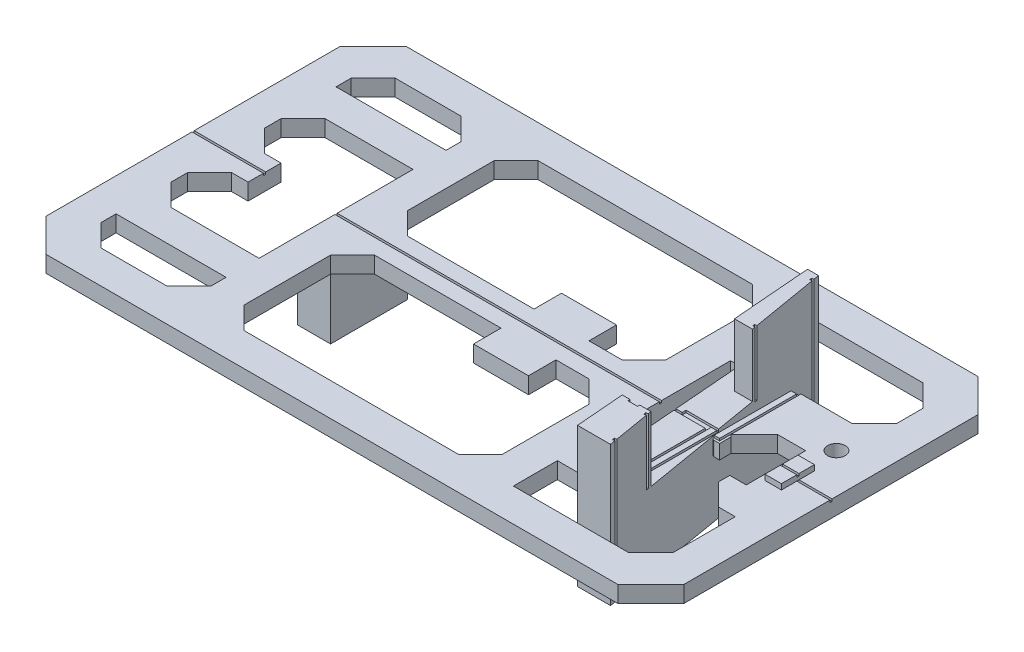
SolidWorks part; units mm, degrees
ref_plane "Front Plane" through (0, 0, 0) normal (0, 0, 1) x (1, 0, 0)
ref_plane "Top Plane" through (0, 0, 0) normal (0, 1, 0) x (1, 0, 0)
ref_plane "Right Plane" through (0, 0, 0) normal (1, 0, 0) x (0, 0, -1)
sketch "Sketch1" plane through (0, 0, 0) normal (0, 1, 0) x (1, 0, 0)
  line L0 (58, 0) -> (21.5339, 0) construction
  line L1 (57, -32.75) -> (-47, -32.75)
  line L2 (-53, -26.75) -> (-53, 26.75)
  line L3 (57, 32.75) -> (-47, 32.75)
  line L4 (-53, 26.75) -> (-47, 32.75)
  line L5 (-47, -32.75) -> (-53, -26.75)
  line L6 (63, -26.75) -> (57, -32.75)
  line L7 (63, 26.75) -> (57, 32.75)
  line L8 (43.65, -0.9) -> (43.65, 1.2)
  line L9 (57, 17.9) -> (53, 13.9)
  line L10 (-40, -3) -> (-40, 3)
  line L11 (26, -7) -> (26, -22.75)
  line L12 (53, -26.75) -> (57, -22.75)
  line L13 (32, -18.75) -> (32, -26.75)
  line L14 (-27, 14) -> (-27, -14)
  line L15 (32, 5) -> (32, -28.4056) construction
  line L16 (57, 17.9) -> (57, 22.75)
  line L17 (53, 26.75) -> (57, 22.75)
  line L18 (36.3225, 18.75) -> (36, 22.75)
  line L19 (39.6688, -22.75) -> (39.3462, -18.75)
  line L20 (42.25, -0.5) -> (42.25, 9.5)
  line L21 (-27, 22.75) -> (-27, 7) construction
  line L22 (-31, 26.75) -> (-43, 26.75)
  line L23 (-21, 22.75) -> (-21, 7)
  line L24 (26, 22.75) -> (26, 7)
  line L25 (63, -26.75) -> (63, 26.75)
  line L26 (26, 7) -> (22, 3)
  line L27 (53, 13.9) -> (42.25, 13.9)
  line L28 (22, 26.75) -> (26, 22.75)
  line L29 (26, 5) -> (26, -28.4056) construction
  line L30 (22, -3) -> (26, -7)
  line L31 (26, -22.75) -> (22, -26.75)
  line L32 (32, -18.75) -> (39.3462, -18.75)
  line L33 (32, -26.75) -> (53, -26.75)
  line L34 (16, 8) -> (6, 8)
  line L35 (45.6685, -22.75) -> (39.6688, -22.75)
  line L36 (57, -11.4) -> (57, -22.75)
  line L37 (-21, -7) -> (-21, -22.75)
  line L38 (45.6685, -22.75) -> (38, 22.75)
  line L39 (41.85, 9.9) -> (41.85, 13.5)
  line L40 (50, -5.4) -> (53, -5.4)
  line L41 (22, 26.75) -> (-17, 26.75)
  line L42 (47.85, 5.4) -> (43.65, 1.2)
  line L43 (16, -8) -> (6, -8)
  line L44 (-47, 20) -> (-47, 22.75)
  line L45 (43.65, -0.9) -> (42.65, -0.9)
  line L46 (16, 8) -> (16, 3)
  line L47 (53, 5.4) -> (53, -5.4)
  line L48 (32, 18.75) -> (32, 26.75)
  line L49 (54, -11.4) -> (57, -11.4)
  line L50 (32, 26.75) -> (53, 26.75)
  line L51 (43.65, -0.5) -> (43.65, 9.5) construction
  line L52 (38, 22.75) -> (36, 22.75)
  line L53 (32, 18.75) -> (36.3225, 18.75)
  line L54 (47.85, -11.4) -> (53, -11.4) construction
  line L55 (41.85, -0.5) -> (41.85, 13.5) construction
  line L56 (6, 8) -> (6, 3)
  line L57 (-27, 14) -> (-43, 14)
  line L58 (32, -12.75) -> (35.6569, -12.75)
  line L59 (22, 3) -> (16, 3)
  line L60 (58, 8) -> (21.5339, 8) construction
  line L61 (32, 12.75) -> (33.6008, 12.75)
  line L62 (42.25, -0.5) -> (42.25, 13.5) construction
  line L63 (6, 22.75) -> (6, 7) construction
  line L64 (32, 12.75) -> (32, -12.75)
  line L65 (32, 12.75) -> (36.3225, 12.75) construction
  line L66 (32, -12.75) -> (39.3462, -12.75) construction
  line L67 (22, -3) -> (16, -3)
  line L68 (58, -8) -> (21.5339, -8) construction
  line L69 (33.6008, 12.75) -> (35.6569, -12.75)
  line L70 (16, 22.75) -> (16, 7) construction
  line L71 (6, -3) -> (6, -8)
  line L72 (16, -3) -> (16, -8)
  line L73 (6, 3) -> (-17, 3)
  line L74 (6, -3) -> (-17, -3)
  line L75 (22, -26.75) -> (-17, -26.75)
  line L76 (-27, -14) -> (-43, -14)
  line L77 (50, -7.4) -> (54, -11.4)
  line L78 (50, -5.4) -> (50, -7.4)
  line L79 (-40, -26.75) -> (-40, 26.75) construction
  line L80 (-27, 20) -> (-47, 20)
  line L81 (-27, 22.75) -> (-27, 20)
  line L82 (-27, -20) -> (-27, -22.75)
  line L83 (-31, -26.75) -> (-43, -26.75)
  line L84 (-27, 20) -> (-40, 20) construction
  line L85 (-47, -26.75) -> (-47, 26.75) construction
  line L86 (-17, 26.75) -> (-21, 22.75)
  line L87 (-27, 22.75) -> (-27, 7) construction
  line L88 (-21, -22.75) -> (-17, -26.75)
  line L89 (-17, -3) -> (-21, -7)
  line L90 (-17, 3) -> (-21, 7)
  line L91 (57, 26.75) -> (-47, 26.75) construction
  line L92 (-27, -7) -> (-27, -22.75) construction
  line L93 (57, -26.75) -> (-47, -26.75) construction
  line L94 (-47, -20) -> (-47, -22.75)
  line L95 (-27, -20) -> (-47, -20)
  line L96 (-27, -20) -> (-40, -20) construction
  line L97 (-43, -26.75) -> (-47, -22.75)
  line L98 (-47, 22.75) -> (-43, 26.75)
  line L99 (-43, 14) -> (-47, 10)
  line L100 (-43, -3) -> (-40, -3)
  line L101 (-43, 3) -> (-40, 3)
  line L102 (-47, 10) -> (-47, 7)
  line L103 (-47, -10) -> (-47, -7)
  line L104 (-47, 7) -> (-43, 3)
  line L105 (-47, -7) -> (-43, -3)
  line L106 (-27, 14) -> (-40, 14) construction
  line L107 (-27, -14) -> (-40, -14) construction
  line L108 (-43, -14) -> (-47, -10)
  line L109 (-31, 26.75) -> (-27, 22.75)
  line L110 (-27, -22.75) -> (-31, -26.75)
  line L111 (47.85, 5.4) -> (53, 5.4)
  line L112 (50, 5.4) -> (50, -5.4) construction
  line L113 (47.85, -5.4) -> (53, -5.4) construction
  circle A0 centre (55.7955, 8.2073) radius 1.6
  arc A3 (42.65, -0.9) -> (42.25, -0.5) centre (42.65, -0.5) cw
  arc A8 (41.85, 9.9) -> (42.25, 9.5) centre (42.25, 9.9) ccw
  arc A9 (42.25, 13.9) -> (41.85, 13.5) centre (42.25, 13.5) ccw
  point P2 (-53, 32.75)
  point P3 (-53, -32.75)
  point P5 (57, 26.75)
  point P15 (57, 13.9)
  point P28 (63, -32.75)
  point P29 (57, -26.75)
  point P31 (63, 32.75)
  point P51 (-21, -3)
  point P55 (26, -26.75)
  point P83 (26, 26.75)
  point P95 (26, -3)
  point P98 (26, 3)
  point P116 (-27, 26.75)
  point P117 (-27, -26.75)
  point P132 (47.85, 1.2)
  point P137 (50, -11.4)
  point P143 (-47, 14)
  point P144 (-47, -3)
  point P147 (-47, 3)
  point P148 (-47, -14)
  dimension "D20" = 10
  dimension "D3" = 6
  dimension "D12" = 0.4
  dimension "D19" = 0.4
  dimension "D26" = 6
  dimension "D15" = 8
  dimension "D5" = 6
  dimension "D10" = 6
  dimension "D11" = 8
  dimension "D17" = 10
  dimension "D21" = 6
  dimension "D22" = 6
  dimension "D24" = 6
  dimension "D25" = 6
  dimension "D27" = 3
  dimension "D7" = 1.4
  dimension "D8" = 13
  dimension "D29" = 0.4
  dimension "D9" = 6
extrude "Boss-Extrude1" add sketch "Sketch1" along normal blind 3
sketch "Sketch2" plane through (0, 3, 0) normal (0, 1, 0) x (1, 0, 0)
  line L0 (43.65, 0.1843) -> (63, 0.2055)
  line L1 (40.75, 0.5) -> (40.75, -13.5)
  line L2 (48.25, -13.9) -> (48.25, -0.2)
  line L3 (-53, -0.2) -> (40.35, -0.2)
  line L4 (-53, 0.2) -> (35.75, 0.2)
  line L6 (35.75, 0.9) -> (35.75, 0.2)
  line L7 (41.75, -13.5) -> (41.75, 0.5)
  line L10 (48.25, -0.2) -> (63, -0.2)
  line L13 (35.75, 0.5) -> (35.75, -13.5) construction
  line L14 (42.25, 13.5) -> (43.25, 13.5)
  line L15 (43.25, 13.5) -> (43.25, -0.5)
  line L16 (43.25, -0.5) -> (42.25, -0.5)
  line L17 (41.75, 0.5) -> (40.75, 0.5)
  line L18 (41.75, -13.5) -> (40.75, -13.5)
  line L20 (40.35, -13.9) -> (48.25, -13.9)
  line L22 (41.8, 0.9) -> (35.75, 0.9)
  line L24 (-58, 0.2) -> (40.35, 0.2) construction
  line L25 (40.35, -13.9) -> (40.35, -0.2)
  line L27 (63, -0.2) -> (63, 0.2055)
  line L28 (41.8, 0.9) -> (41.8, 13.9)
  line L30 (-53, 0.2) -> (-53, -0.2)
  line L31 (43.65, 13.9) -> (41.8, 13.9)
  line L32 (-53, 26.75) -> (-53, -26.75) construction
  line L33 (43.65, 0.1843) -> (43.65, 13.9)
  line L34 (-58, -0.2) -> (40.35, -0.2) construction
  line L38 (42.25, -0.5) -> (42.25, 13.5)
  dimension "D1" = 0.4
  dimension "D3" = 5
extrude "Cut-Extrude1" cut sketch "Sketch2" against normal blind 0.4
sketch "Sketch5" plane through (0, 0, 0) normal (0, 1, 0) x (1, 0, 0)
  line L1 (45.6685, -22.75) -> (38, 22.75)
  line L2 (58, 0) -> (-77.055, 0) construction
  line L3 (39.6688, -22.75) -> (36, 22.75)
  line L6 (45.6685, -22.75) -> (39.6688, -22.75)
  line L7 (-21, 7) -> (-27, 7)
  line L8 (-21, 7) -> (-21, -7)
  line L9 (38, 22.75) -> (36, 22.75)
  line L10 (-21, -7) -> (-27, -7)
  line L11 (-27, 7) -> (-27, -7)
extrude "Boss-Extrude2" add sketch "Sketch5" against normal blind 11
sketch "Sketch7" plane through (0, 3, 0) normal (0, 1, 0) x (1, 0, 0)
  line L0 (38, 22.75) -> (40.4354, 8.3)
  line L1 (45.6685, -22.75) -> (39.6688, -22.75)
  line L2 (39.6688, -22.75) -> (38.9552, -13.9)
  line L3 (36, 22.75) -> (38, 22.75)
  line L4 (40.4354, 8.3) -> (37.1651, 8.3)
  line L7 (37.1651, 8.3) -> (36, 22.75)
  line L8 (44.177, -13.9) -> (45.6685, -22.75)
  line L14 (38.9552, -13.9) -> (44.177, -13.9)
extrude "Boss-Extrude3" add sketch "Sketch7" along normal blind 11.4
sketch "Sketch9" plane through (40.6788, 0, -6.856) normal (0.9861, 0, -0.1662) x (-0.1662, 0, -0.9861)
  line L0 (15.1182, 14.4) -> (14.7182, 14.4)
  line L1 (15.1182, 14.4) -> (15.1182, -11)
  line L2 (14.7182, 14.4) -> (14.7182, -11)
  line L3 (15.1182, -11) -> (14.7182, -11)
  line L4 (-28.6235, 14.4) -> (-28.6235, -11)
  line L5 (-29.0235, 14.4) -> (-29.0235, -11)
  line L6 (-28.6235, 14.4) -> (-29.0235, 14.4)
  line L7 (-28.6235, -11) -> (-29.0235, -11)
  line L8 (-21.6487, 2.6) -> (-22.0487, 2.6)
  line L9 (-30.0235, 14.4) -> (-30.0235, -11) construction
  line L10 (-21.6487, 14.8) -> (-22.0487, 14.8)
  line L11 (2.465, 14.7985) -> (2.065, 14.7991)
  line L12 (2.4644, 14.3985) -> (2.4467, 2.6) construction
  line L13 (-22.0487, 14.4) -> (-22.0487, 2.6) construction
  line L14 (2.0467, 2.6) -> (2.4467, 2.6)
  line L21 (16.1182, 14.4) -> (16.1182, -11) construction
  line L23 (-21.6487, 14.8) -> (-21.6487, 2.6)
  line L24 (2.065, 14.7991) -> (2.0467, 2.6)
  line L27 (-21.6487, 14.4) -> (-21.6487, 2.6) construction
  line L32 (-22.0487, 14.8) -> (-22.0487, 2.6)
  line L33 (2.465, 14.7985) -> (2.4467, 2.6)
  line L50 (2.0644, 14.3991) -> (2.0467, 2.6006) construction
  dimension "D3" = 1
  dimension "D4" = 1
  dimension "D1" = 0.4
  dimension "D2" = 0.4
  dimension "D10" = 0.4
  dimension "D11" = 0.4
extrude "Cut-Extrude5" cut sketch "Sketch9" against normal blind 0.4
sketch "Sketch10" plane through (0, 0, 13.9) normal (0, 0, -1) x (-1, 0, 0)
  line L0 (-42.15, 2.6) -> (-42.15, 14.4)
  line L1 (-44.177, 14.4) -> (-38.9552, 14.4) construction
  line L2 (-40.35, 2.6) -> (-40.35, 14.4)
  line L3 (-40.35, 2.6) -> (-42.15, 2.6)
  line L4 (-42.15, 14.4) -> (-40.35, 14.4)
extrude "Cut-Extrude6" cut sketch "Sketch10" against normal blind 0.4
sketch "Sketch12" plane through (0, 3, 0) normal (0, 1, 0) x (1, 0, 0)
  line L0 (57, -3) -> (57, 3)
  line L1 (54, -3) -> (54, 3)
  line L3 (54, -3) -> (57, -3)
  line L4 (54, 3) -> (57, 3)
  line L5 (54, -7) -> (54, 8.9071) construction
  line L6 (57, -7) -> (57, 8.9071) construction
  dimension "D1" = 3
extrude "Boss-Extrude4" add sketch "Sketch12" along normal blind 1
sketch "Sketch13" plane through (0, 4, 0) normal (0, 1, 0) x (1, 0, 0)
  line L1 (57, 0.1989) -> (54, 0.1989)
  line L2 (57, 0.1989) -> (57, -0.2)
  line L3 (57, -0.2) -> (54, -0.2)
  line L4 (54, 0.1989) -> (54, -0.2)
extrude "Cut-Extrude7" cut sketch "Sketch13" against normal blind 0.4
